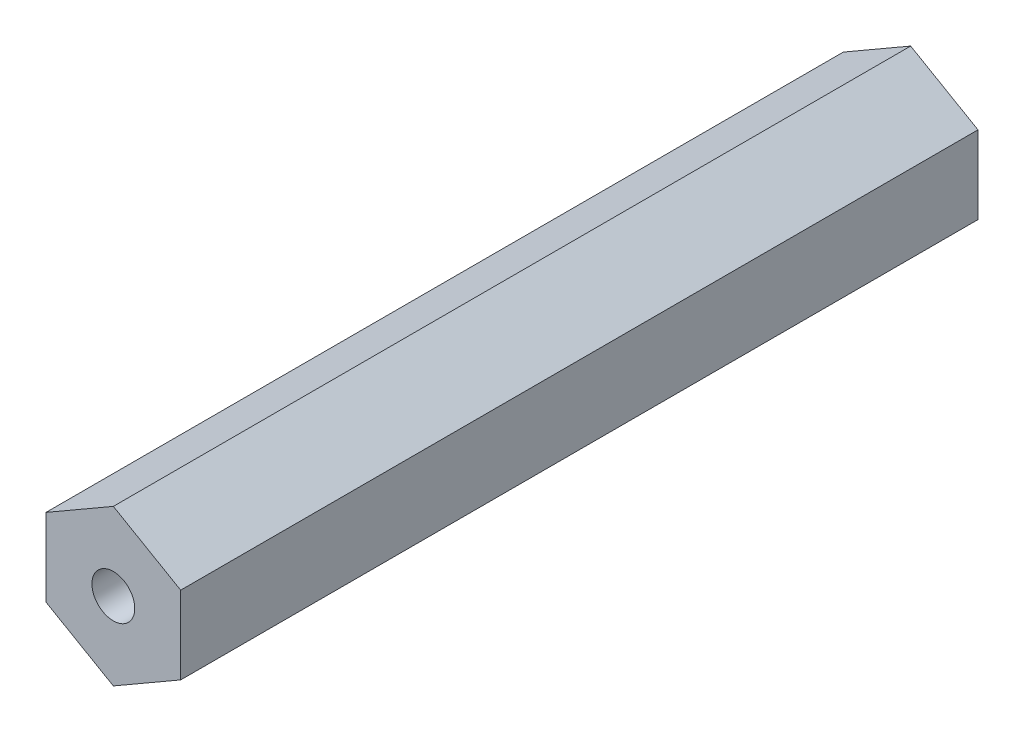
SolidWorks part; units mm, degrees
ref_plane "Front Plane" through (0, 0, 0) normal (0, 0, 1) x (1, 0, 0)
ref_plane "Top Plane" through (0, 0, 0) normal (0, 1, 0) x (1, 0, 0)
ref_plane "Right Plane" through (0, 0, 0) normal (1, 0, 0) x (0, 0, -1)
sketch "Sketch1" plane through (0, 0, 0) normal (0, 0, 1) x (1, 0, 0)
  line L1 (0, 7.3323) -> (-6.35, 3.6662)
  line L2 (-6.35, 3.6662) -> (-6.35, -3.6662)
  line L3 (-6.35, -3.6662) -> (0, -7.3323)
  line L4 (0, -7.3323) -> (6.35, -3.6662)
  line L5 (6.35, -3.6662) -> (6.35, 3.6662)
  line L6 (6.35, 3.6662) -> (0, 7.3323)
  circle A0 centre (0, 0) radius 6.35 construction
  dimension "D1" = 12.7
extrude "Boss-Extrude1" add sketch "Sketch1" along normal blind 75.184
hole_wizard "Tap Drill for #10-32 Tap1" positions "Sketch3" profile "Sketch2" hole size "#10-32" standard "ANSI Inch"
sketch "Sketch3" plane through (0, 0, 0) normal (0, 0, -1) x (-1, 0, 0)
  point P0 (0, 0)
sketch "Sketch2" plane through (0, 0, 0) normal (1, 0, 0) x (0, 1, 0)
  line L0 (0, 0) -> (0, 13.9133)
  line L1 (0, 13.9133) -> (2.0193, 12.7)
  line L2 (2.0193, 12.7) -> (2.0193, 0)
  line L5 (2.0193, 0) -> (0, 0)
  line L10 (0, 13.9133) -> (-2.0193, 12.7) construction
  line L11 (0, -6.35) -> (0, 107.95) construction
  dimension "Hole Dia." = 4.0386
  dimension "Hole Depth" = 12.7
  dimension "Drill Angle" = 118
hole_wizard "Tap Drill for #10-32 Tap2" positions "3DSketch1" profile "Sketch4" hole size "#10-32" standard "ANSI Inch"
sketch3d "3DSketch1"
  line L0 (-6.35, 3.6662, 75.184) -> (6.35, -3.6662, 75.184) construction
  line L1 (0, 7.3323, 75.184) -> (0, -7.3323, 75.184) construction
  point P21 (0, 0, 75.184)
  point P23 (0, 0, 75.184)
  point P25 (0, 0, 75.184)
  point P27 (0, 0, 75.184)
  point P29 (0, 0, 75.184)
  point P31 (0, 0, 75.184)
  point P33 (0, 0, 75.184)
  point P35 (0, 0, 75.184)
  point P37 (0, 0, 75.184)
sketch "Sketch4" plane through (0, 0, 75.184) normal (1, 0, 0) x (0, -1, 0)
  line L0 (0, 0) -> (0, 13.9133)
  line L1 (0, 13.9133) -> (2.0193, 12.7)
  line L2 (2.0193, 12.7) -> (2.0193, 0)
  line L5 (2.0193, 0) -> (0, 0)
  line L10 (0, 13.9133) -> (-2.0193, 12.7) construction
  line L11 (0, -6.35) -> (0, 107.95) construction
  dimension "Hole Dia." = 4.0386
  dimension "Hole Depth" = 12.7
  dimension "Drill Angle" = 118
